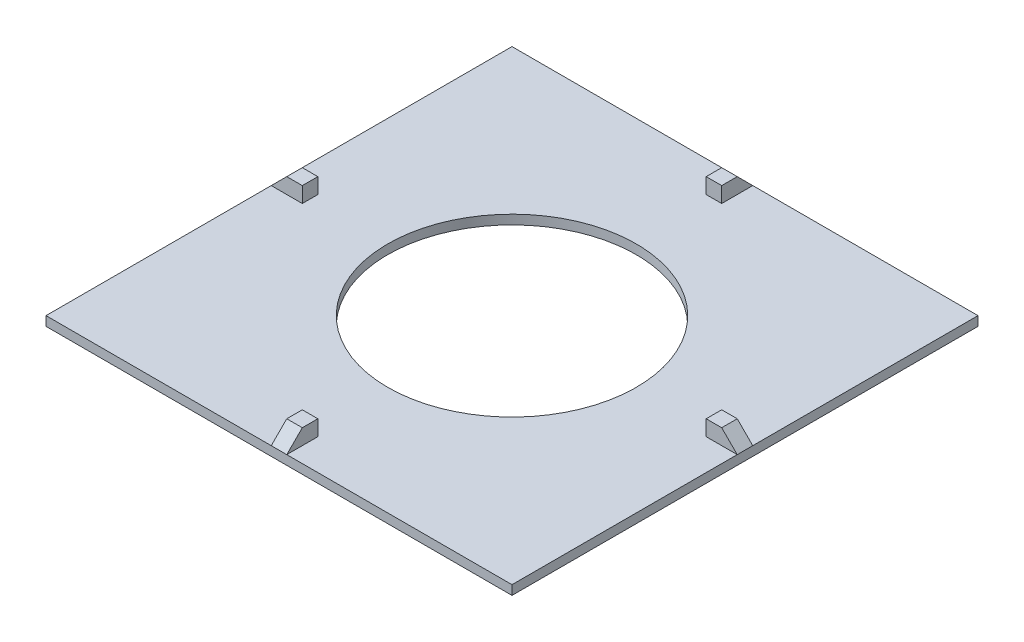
SolidWorks part; units mm, degrees
ref_plane "Alzado" through (0, 0, 0) normal (0, 0, 1) x (1, 0, 0)
ref_plane "Planta" through (0, 0, 0) normal (0, 1, 0) x (1, 0, 0)
ref_plane "Vista lateral" through (0, 0, 0) normal (1, 0, 0) x (0, 0, -1)
sketch "Croquis1" plane through (0, 0, 0) normal (0, 1, 0) x (1, 0, 0)
  line L1 (-75, 75) -> (75, 75)
  line L2 (-75, 75) -> (-75, -75)
  line L3 (-75, -75) -> (75, -75)
  line L4 (75, 75) -> (75, -75)
  line L5 (-75, 75) -> (75, -75) construction
  line L6 (-75, -75) -> (75, 75) construction
  circle A0 centre (0, 0) radius 40
  point P0 (0, 0)
  dimension "D2" = 80
  dimension "D1" = 150
extrude "Saliente-Extruir1" add sketch "Croquis1" along normal mid plane 3
sketch "Croquis2" plane through (0, 1.5, 0) normal (0, 1, 0) x (1, 0, 0)
  line L0 (75, -75) -> (75, 75) construction
  line L1 (65, 2.5) -> (75, 2.5)
  line L2 (65, 2.5) -> (65, -2.5)
  line L3 (65, -2.5) -> (75, -2.5)
  line L4 (75, 2.5) -> (75, -2.5)
  line L5 (-75, 75) -> (-75, -75) construction
  line L6 (-75, -2.5) -> (-65, -2.5)
  line L7 (-75, -2.5) -> (-75, 2.5)
  line L8 (-75, 2.5) -> (-65, 2.5)
  line L9 (-65, -2.5) -> (-65, 2.5)
  line L10 (-65, 0) -> (65, 0) construction
  line L11 (75, 75) -> (-75, 75) construction
  line L12 (-2.5, 75) -> (2.5, 75)
  line L13 (-2.5, 75) -> (-2.5, 65)
  line L14 (-2.5, 65) -> (2.5, 65)
  line L15 (2.5, 75) -> (2.5, 65)
  line L16 (0, 65) -> (0, 0) construction
  line L17 (2.5, -75) -> (2.5, -65)
  line L18 (-2.5, -65) -> (2.5, -65)
  line L19 (-2.5, -75) -> (-2.5, -65)
  line L20 (-2.5, -75) -> (2.5, -75)
  point P14 (0, 0)
  dimension "D1" = 5
  dimension "D2" = 10
extrude "Saliente-Extruir2" add sketch "Croquis2" along normal blind 5
chamfer "Chaflán1" distance 5 angle 45 4 edges at (-75, 6.5, 0) (0, 6.5, -75) (75, 6.5, 0) (0, 6.5, 75)
